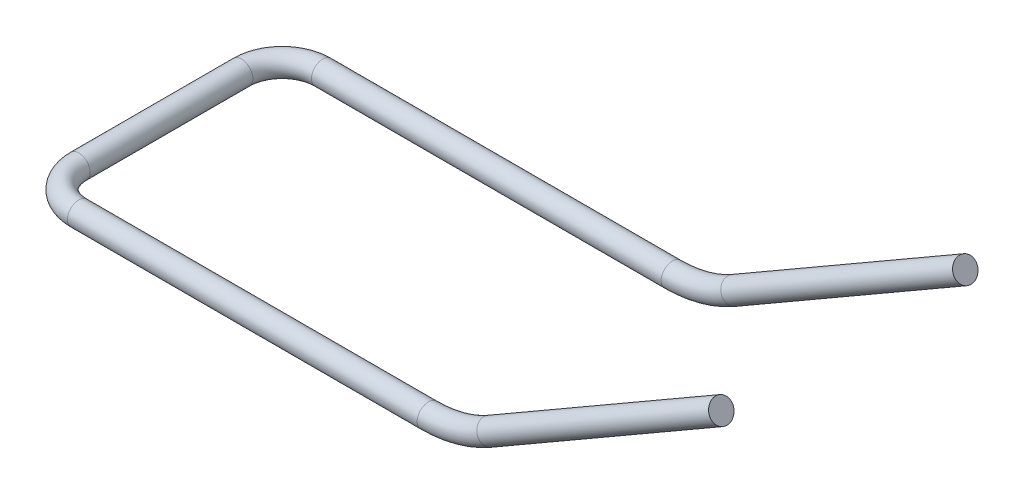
SolidWorks part; units mm, degrees
ref_plane "Front Plane" through (0, 0, 0) normal (0, 0, 1) x (1, 0, 0)
ref_plane "Top Plane" through (0, 0, 0) normal (0, 1, 0) x (1, 0, 0)
ref_plane "Right Plane" through (0, 0, 0) normal (1, 0, 0) x (0, 0, -1)
sketch "Sketch1" plane through (0, 0, 0) normal (0, 1, 0) x (1, 0, 0)
  line L0 (0, 0) -> (330.4297, 0) construction
  line L1 (25, 75) -> (420, 75)
  line L2 (0, 50) -> (0, -50)
  line L3 (25, -75) -> (420, -75)
  arc A0 (0, -50) -> (25, -75) centre (25, -50) ccw
  arc A1 (25, 75) -> (0, 50) centre (25, 50) ccw
  dimension "D4" = 25
  dimension "D1" = 420
  dimension "D2" = 150
sketch "Sketch2" plane through (0, 0, 0) normal (0, 0, 1) x (1, 0, 0)
  line L0 (0, 0) -> (240, 0)
  line L1 (25, 0) -> (420, 0) construction
  line L2 (277.5, 10.0481) -> (420, 92.3205)
  arc A0 (240, 0) -> (277.5, 10.0481) centre (240, 75) ccw
  point P8 (260.0962, 0)
  dimension "D1" = 75
  dimension "D2" = 240
  dimension "D3" = 150
  dimension "D4" = 420
curve "Curve1"
ref_plane "Plane1" through (420, 92.3205, 75) normal (0.866, 0.5, 0) x (0, 0, -1)
sketch "Sketch3" plane through (420, 92.3205, 75) normal (0.866, 0.5, 0) x (0, 0, -1)
  circle A0 centre (0, 0) radius 7
  dimension "D1" = 14
sweep "Sweep1" add profiles "Sketch3" path "Curve1"
